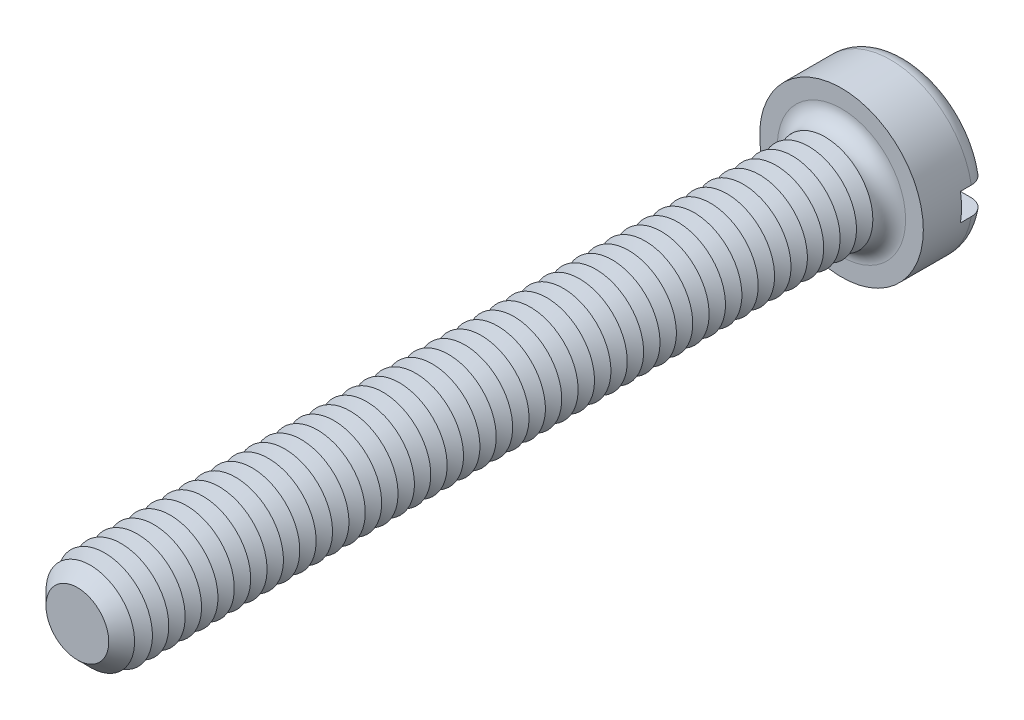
SolidWorks part; units mm, degrees
ref_plane "Front Plane" through (0, 0, 0) normal (0, 0, 1) x (1, 0, 0)
ref_plane "Top Plane" through (0, 0, 0) normal (0, 1, 0) x (1, 0, 0)
ref_plane "Right Plane" through (0, 0, 0) normal (1, 0, 0) x (0, 0, -1)
sketch "Sketch3" plane through (0, 0, 0) normal (0, 0, 1) x (1, 0, 0)
  circle A0 centre (0, 0) radius 3
  dimension "D1" = 6
extrude "Boss-Extrude2" add sketch "Sketch3" against normal blind 2.4
sketch "Sketch4" plane through (0, 0, 0) normal (0, 0, 1) x (1, 0, 0)
  circle A0 centre (0, 0) radius 1.75
  dimension "D1" = 3.5
extrude "Boss-Extrude3" add sketch "Sketch4" along normal blind 28
fillet "Fillet1" radius 0.6 2 edges at (3, 0, -2.4) (1.75, 0, 0)
chamfer "Chamfer1" distance 0.6 angle 45 1 edges at (1.75, 0, 28)
sketch "Sketch5" plane through (0, 0, 0) normal (1, 0, 0) x (0, 0, -1)
  line L0 (1.6944, 0) -> (-7.6738, 0) construction
sketch "Sketch6" plane through (0, 0, 0) normal (1, 0, 0) x (0, 0, -1)
  line L0 (-0.6, 1.75) -> (-0.9, 1.2304)
  line L1 (-0.9, 1.2304) -> (-1.2, 1.75)
  line L2 (-0.6, 1.75) -> (-27.4, 1.75) construction
  line L3 (-1.2, 1.75) -> (-0.6, 1.75)
  dimension "D1" = 0.6
revolve "Cut-Revolve1" cut sketch "Sketch6" angle 360 about L0
pattern_linear "LPattern1" count 45 spacing 0.6 along (0, 0, 1) of "Cut-Revolve1"
sketch "Sketch8" plane through (0, 0, -2.4) normal (0, 0, -1) x (-1, 0, 0)
  line L1 (3, -0.5) -> (-3, -0.5)
  line L2 (3, -0.5) -> (3, 0.5)
  line L3 (3, 0.5) -> (-3, 0.5)
  line L4 (-3, -0.5) -> (-3, 0.5)
  line L5 (3, -0.5) -> (-3, 0.5) construction
  line L6 (3, 0.5) -> (-3, -0.5) construction
  point P0 (0, 0)
  dimension "D1" = 6
  dimension "D2" = 1
extrude "Cut-Extrude1" cut sketch "Sketch8" against normal blind 1
